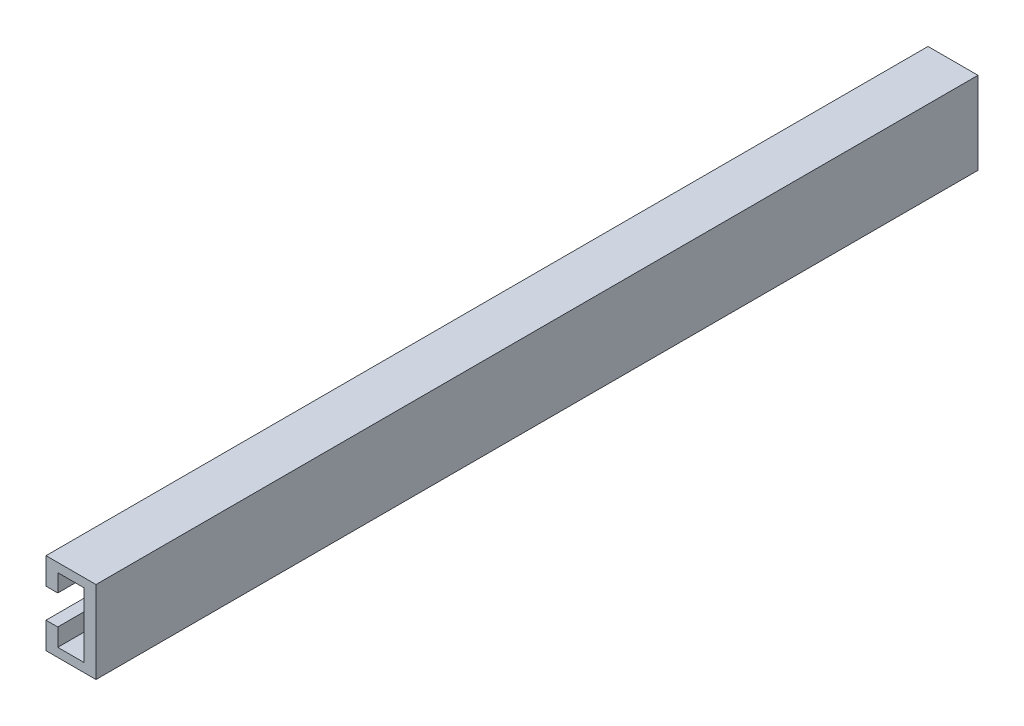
SolidWorks part; units mm, degrees
ref_plane "Alzado" through (0, 0, 0) normal (0, 0, 1) x (1, 0, 0)
ref_plane "Planta" through (0, 0, 0) normal (0, 1, 0) x (1, 0, 0)
ref_plane "Vista lateral" through (0, 0, 0) normal (1, 0, 0) x (0, 0, -1)
sketch "Croquis1" plane through (0, 0, 0) normal (0, 0, 1) x (1, 0, 0)
  line L0 (-8.5, -5) -> (-8.5, -14)
  line L1 (-4.5, 11) -> (4.5, 11)
  line L2 (-4.5, 11) -> (-4.5, 5)
  line L3 (-4.5, -11) -> (4.5, -11)
  line L4 (4.5, 11) -> (4.5, -11)
  line L5 (-8.5, 14) -> (8.5, 14)
  line L6 (-8.5, 14) -> (-8.5, 5)
  line L7 (-8.5, -14) -> (8.5, -14)
  line L8 (8.5, 14) -> (8.5, -14)
  line L9 (-4.5, 5) -> (-8.5, 5)
  line L11 (-4.5, -5) -> (-8.5, -5)
  line L13 (-4.5, -5) -> (-4.5, -11)
  dimension "D1" = 11
  dimension "D2" = 22
  dimension "D3" = 9
  dimension "D4" = 4.5
  dimension "D5" = 17
  dimension "D6" = 8.5
  dimension "D7" = 14
  dimension "D8" = 10
  dimension "28" = 28
  dimension "D9" = 4
extrude "Saliente-Extruir1" add sketch "Croquis1" along normal mid plane 300
